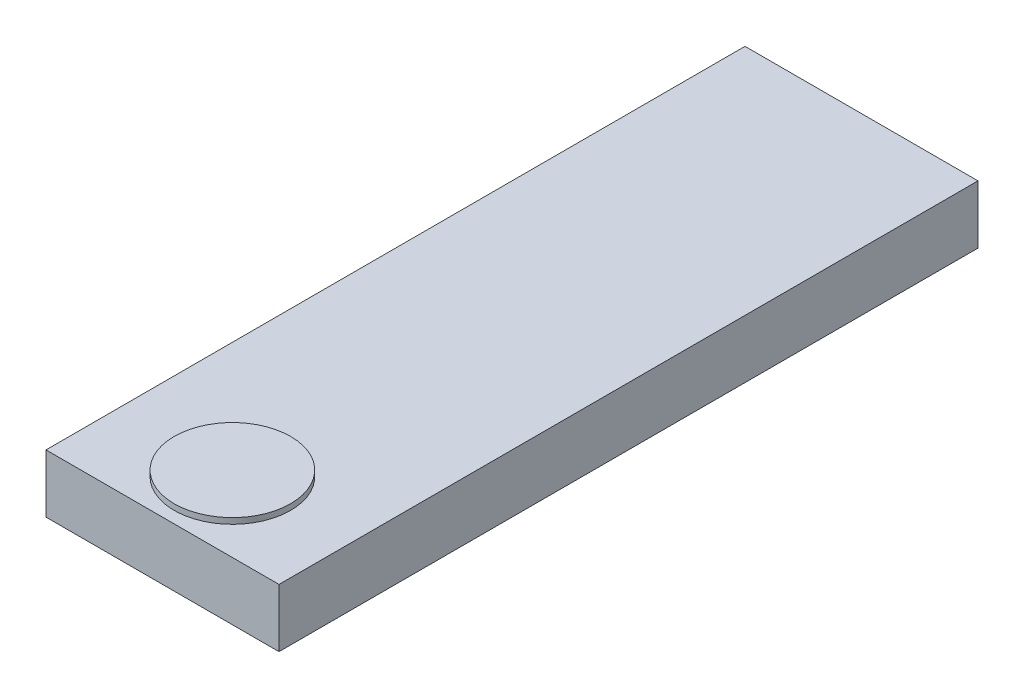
SolidWorks part; units mm, degrees
ref_plane "Front Plane" through (0, 0, 0) normal (0, 0, 1) x (1, 0, 0)
ref_plane "Top Plane" through (0, 0, 0) normal (0, 1, 0) x (1, 0, 0)
ref_plane "Right Plane" through (0, 0, 0) normal (1, 0, 0) x (0, 0, -1)
sketch "Sketch1" plane through (0, 0, 0) normal (0, 0, 1) x (1, 0, 0)
  line L1 (-25.4, 0) -> (25.4, 0)
  line L2 (-25.4, 0) -> (-25.4, -12.7)
  line L3 (-25.4, -12.7) -> (25.4, -12.7)
  line L4 (25.4, 0) -> (25.4, -12.7)
  dimension "D1" = 50.8
  dimension "D2" = 12.7
extrude "Boss-Extrude1" add sketch "Sketch1" along normal blind 152.4
sketch "Sketch2" plane through (0, 0, 0) normal (0, 1, 0) x (1, 0, 0)
  line L0 (0, 0) -> (0, -137.16) construction
  line L1 (25.4, -152.4) -> (-25.4, -152.4) construction
  circle A0 centre (0, -137.16) radius 12.7
  dimension "D1" = 25.4
  dimension "D2" = 15.24
extrude "Boss-Extrude2" add sketch "Sketch2" along normal blind 1.27
